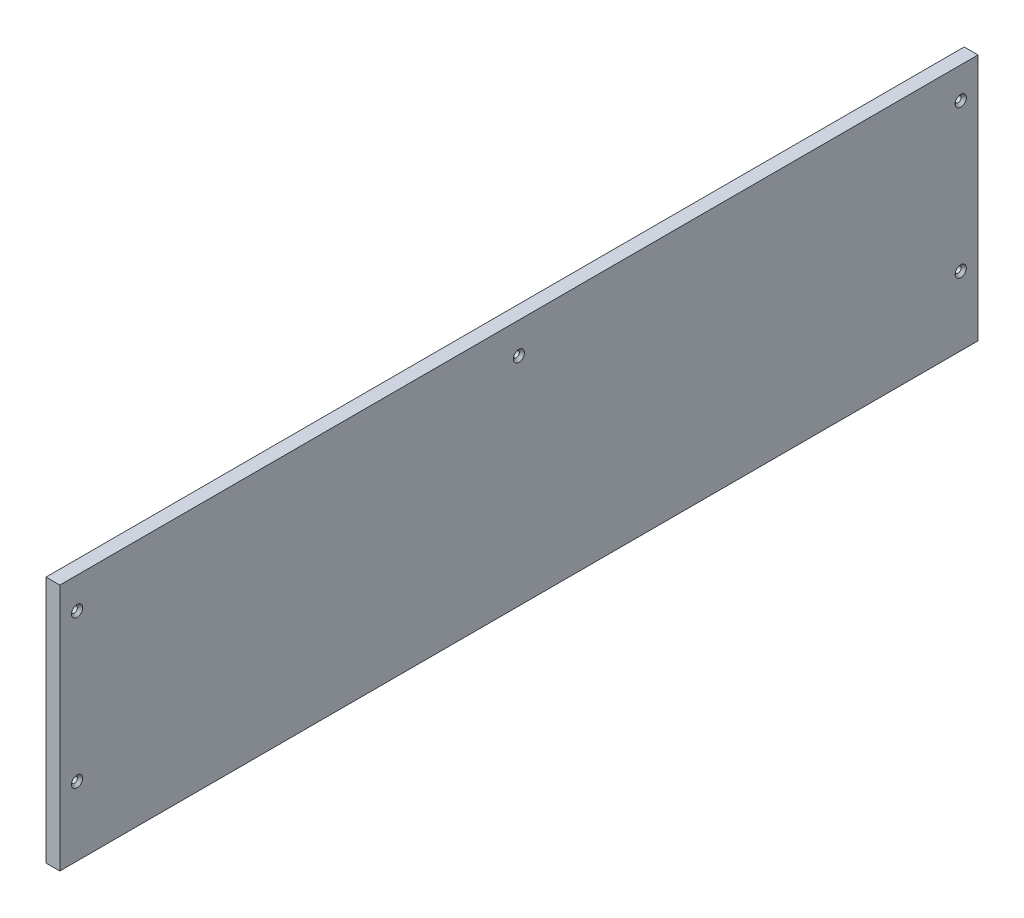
SolidWorks part; units mm, degrees
ref_plane "Ebene vorne" through (0, 0, 0) normal (0, 0, 1) x (1, 0, 0)
ref_plane "Ebene oben" through (0, 0, 0) normal (0, 1, 0) x (1, 0, 0)
ref_plane "Ebene rechts" through (0, 0, 0) normal (1, 0, 0) x (0, 0, -1)
sketch "Skizze1" plane through (0, 0, 0) normal (1, 0, 0) x (0, 0, -1)
  line L1 (-266, -71.75) -> (266, -71.75)
  line L2 (-266, -71.75) -> (-266, 71.75)
  line L3 (-266, 71.75) -> (266, 71.75)
  line L4 (266, -71.75) -> (266, 71.75)
  line L5 (-266, -71.75) -> (266, 71.75) construction
  line L6 (-266, 71.75) -> (266, -71.75) construction
  point P0 (0, 0)
  dimension "D1" = 532
  dimension "D2" = 143.5
extrude "Aufsatz-Linear austragen1" add sketch "Skizze1" along normal blind 8
hole_wizard "Ø3.5 (3.5) Durchmesser Bohrung1" positions "Skizze2" profile "Skizze3" hole size "Ø3.5" standard "DIN"
sketch "Skizze2" plane through (0, 0, 0) normal (-1, 0, 0) x (0, 0, 1)
  line L0 (-266, 71.75) -> (266, 71.75) construction
  line L1 (266, 71.75) -> (266, -71.75) construction
  line L2 (-266, -71.75) -> (-266, 71.75) construction
  line L3 (266, -71.75) -> (-266, -71.75) construction
  point P0 (-256, -31.75)
  point P2 (-256, 53.75)
  point P4 (0, 53.75)
  point P6 (256, 53.75)
  point P8 (256, -31.75)
  dimension "D1" = 18
  dimension "D2" = 10
  dimension "D3" = 10
  dimension "D4" = 40
sketch "Skizze3" plane through (0, -31.75, -256) normal (0, 1, 0) x (0, 0, 1)
  line L0 (0, 0) -> (0, 8)
  line L1 (0, 8) -> (1.75, 8)
  line L2 (1.75, 8) -> (1.75, 0)
  line L5 (1.75, 0) -> (0, 0)
  line L11 (0, -6.35) -> (0, 107.95) construction
  dimension "Bohrerdurchmesser" = 3.5
  dimension "Bohrungstiefe" = 8
chamfer "Fase1" distance 1.5 angle 45 5 edges at (8, -31.75, -254.25) (8, 53.75, -254.25) (8, 53.75, 1.75) (8, -31.75, 257.75) (8, 53.75, 257.75)
